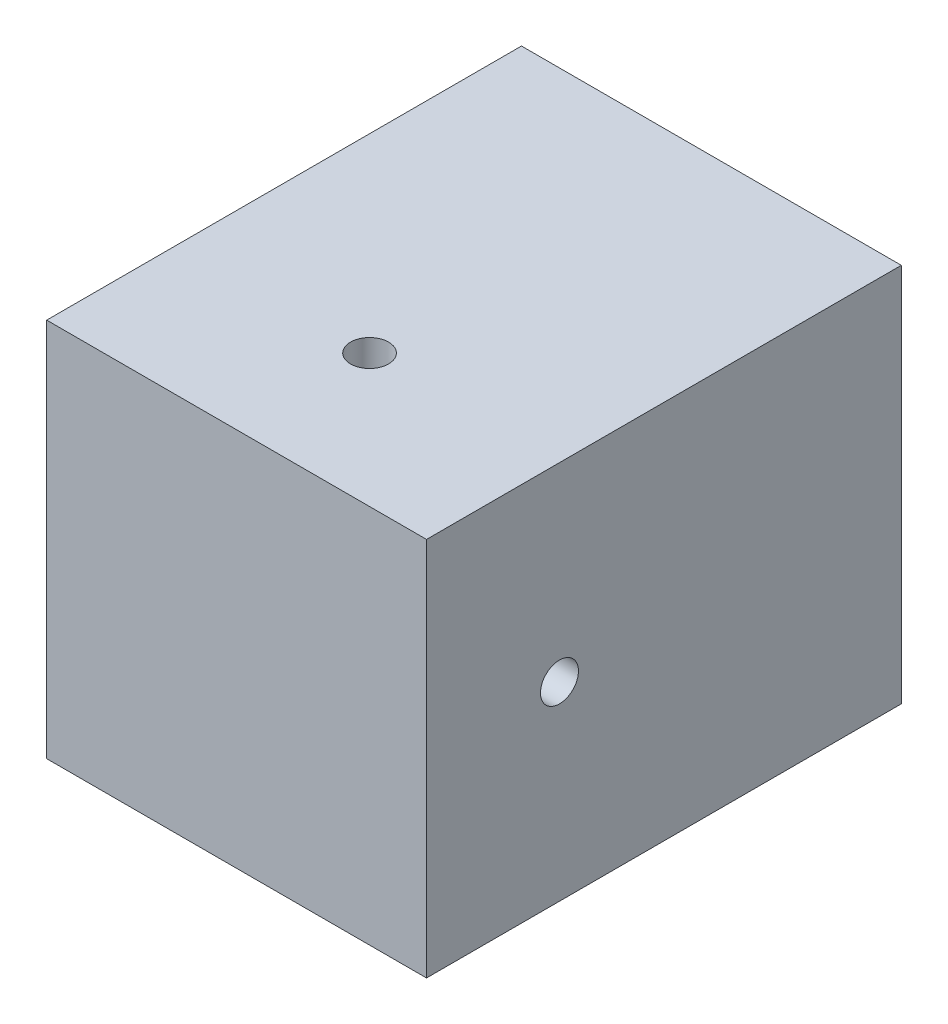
SolidWorks part; units mm, degrees
ref_plane "Front Plane" through (0, 0, 0) normal (0, 0, 1) x (1, 0, 0)
ref_plane "Top Plane" through (0, 0, 0) normal (0, 1, 0) x (1, 0, 0)
ref_plane "Right Plane" through (0, 0, 0) normal (1, 0, 0) x (0, 0, -1)
sketch "Sketch1" plane through (0, 0, 0) normal (0, 0, 1) x (1, 0, 0)
  line L1 (-10, 10) -> (10, 10)
  line L2 (-10, 10) -> (-10, -10)
  line L3 (-10, -10) -> (10, -10)
  line L4 (10, 10) -> (10, -10)
  line L5 (-10, 10) -> (10, -10) construction
  line L6 (-10, -10) -> (10, 10) construction
  point P0 (0, 0)
  dimension "D1" = 20
  dimension "D2" = 20
extrude "Boss-Extrude1" add sketch "Sketch1" along normal blind 25
sketch "Sketch2" plane through (10, 0, 0) normal (1, 0, 0) x (0, 0, -1)
  line L0 (0, -10) -> (0, 10) construction
  circle A0 centre (-18, 0) radius 1
  dimension "D1" = 18
extrude "Cut-Extrude1" cut sketch "Sketch2" against normal blind 25
sketch "Sketch3" plane through (0, 10, 0) normal (0, 1, 0) x (1, 0, 0)
  line L0 (10, 0) -> (-10, 0) construction
  circle A0 centre (0, -18) radius 1
  dimension "D1" = 18
extrude "Cut-Extrude2" cut sketch "Sketch3" against normal blind 25
